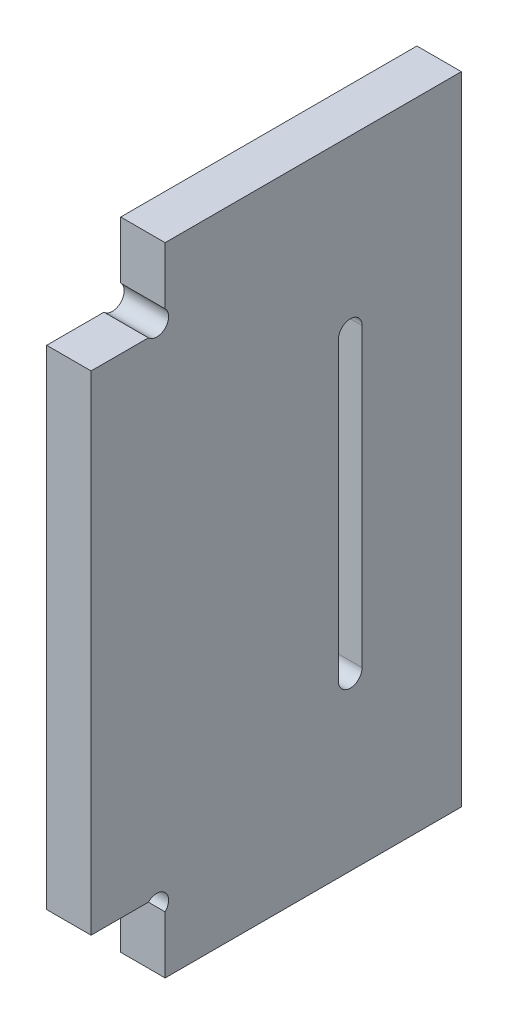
SolidWorks part; units mm, degrees
ref_plane "Plan de face" through (0, 0, 0) normal (0, 0, 1) x (1, 0, 0)
ref_plane "Plan de dessus" through (0, 0, 0) normal (0, 1, 0) x (1, 0, 0)
ref_plane "Plan de droite" through (0, 0, 0) normal (1, 0, 0) x (0, 0, -1)
sketch "Esquisse1" plane through (0, 0, 0) normal (1, 0, 0) x (0, 0, -1)
  line L0 (70, 156.0327) -> (70, 228.8005) construction
  line L1 (0, -10) -> (0, 300) construction
  line L2 (120, -10) -> (120, 300) construction
  line L3 (80, 173) -> (72.3218, 165.3218) construction
  line L4 (120, 249) -> (80, 249)
  line L5 (93.7878, 173) -> (68.4603, 173) construction
  line L6 (77.7373, 173) -> (70, 173)
  line L7 (-20, 163) -> (140, 163) construction
  line L8 (77.7373, 239) -> (70, 239)
  line L9 (80, 163) -> (80, 170.7373)
  line L10 (-20, 249) -> (140, 249) construction
  line L11 (60, 320.0265) -> (60, -23.3948) construction
  line L12 (70, 173) -> (70, 239)
  line L13 (80, 241.2627) -> (80, 249)
  line L38 (90, 310.1112) -> (90, -15.2075) construction
  line L46 (80, 163) -> (120, 163)
  line L49 (120, 163) -> (120, 249)
  line L50 (80, -10) -> (80, 300) construction
  line L84 (105, 325.8851) -> (105, -46.468) construction
  line L86 (170.2936, 206) -> (-16.5119, 206) construction
  line L89 (170.2936, 186) -> (94.9816, 186) construction
  line L90 (94.9816, 226) -> (170.2936, 226) construction
  line L93 (106.6, 226) -> (106.6, 186)
  line L94 (103.4, 186) -> (103.4, 226)
  line L98 (106.6, 234.8116) -> (106.6, 58) construction
  line L99 (103.4, 58) -> (103.4, 234.8116) construction
  arc A0 (80, 170.7373) -> (77.7373, 173) centre (78.8686, 171.8686) ccw
  arc A1 (80, 241.2627) -> (77.7373, 239) centre (78.8686, 240.1314) cw
  arc A42 (103.4, 186) -> (106.6, 186) centre (105, 186) ccw
  arc A43 (106.6, 226) -> (103.4, 226) centre (105, 226) ccw
  dimension "D4" = 43
  dimension "D7" = 10
  dimension "D18" = 15
  dimension "D3" = 40
  dimension "D5" = 43
  dimension "D6" = 10
  dimension "D8" = 45
  dimension "D23" = 20
  dimension "D24" = 20
extrude "Extrusion1" add sketch "Esquisse1" along normal blind 6
sketch "Esquisse2" plane through (0, 0, 0) normal (-1, 0, 0) x (0, 0, 1)
  line L0 (-116, 150.8411) -> (-116, 169.3736) construction
  line L2 (-117.55, 276.9953) -> (-117.55, 150.8411) construction
  line L3 (-114.45, 276.9953) -> (-114.45, 150.8411) construction
  line L15 (47.9717, 156) -> (-169.0565, 156) construction
  line L16 (-63.7346, 206) -> (-138.8552, 206) construction
  line L18 (-129.6973, 167) -> (-100.1112, 167) construction
  line L19 (-117.55, 245) -> (-117.55, 167)
  line L20 (-114.45, 167) -> (-114.45, 245)
  line L22 (-95.55, 167) -> (-95.55, 245)
  line L23 (-92.45, 245) -> (-92.45, 167)
  arc A4 (-117.55, 167) -> (-114.45, 167) centre (-116, 167) ccw
  arc A5 (-117.55, 245) -> (-114.45, 245) centre (-116, 245) cw
  arc A6 (-92.45, 167) -> (-95.55, 167) centre (-94, 167) cw
  arc A7 (-92.45, 245) -> (-95.55, 245) centre (-94, 245) ccw
  dimension "D6" = 39
extrude "Enlèv. mat.-Extru.1" cut sketch "Esquisse2" against normal blind 2.2
